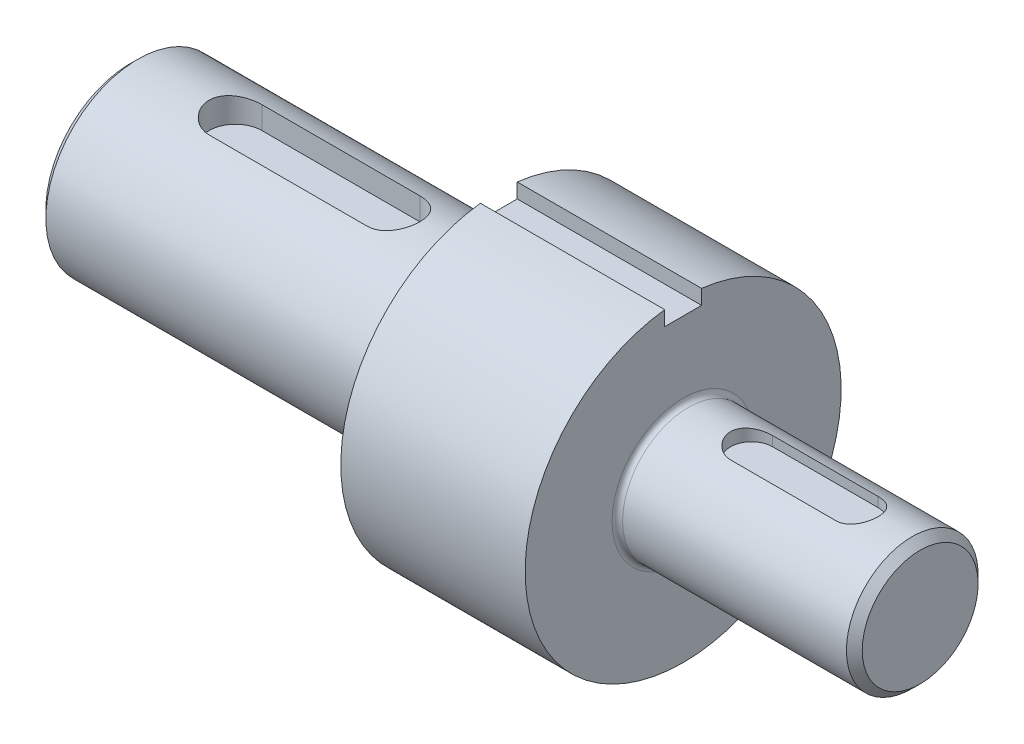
SolidWorks part; units mm, degrees
ref_plane "Ebene vorne" through (0, 0, 0) normal (0, 0, 1) x (1, 0, 0)
ref_plane "Ebene oben" through (0, 0, 0) normal (0, 1, 0) x (1, 0, 0)
ref_plane "Ebene rechts" through (0, 0, 0) normal (1, 0, 0) x (0, 0, -1)
sketch "Skizze1" plane through (0, 0, 0) normal (0, 0, 1) x (1, 0, 0)
  line L0 (0, 0) -> (0, 17.5)
  line L1 (0, 17.5) -> (70, 17.5)
  line L2 (70, 17.5) -> (70, 30)
  line L3 (70, 30) -> (105, 30)
  line L4 (105, 30) -> (105, 12.5)
  line L5 (105, 12.5) -> (150, 12.5)
  line L6 (150, 12.5) -> (150, 0)
  line L7 (150, 0) -> (0, 0)
  line L8 (0, 0) -> (159.1633, 0) construction
  dimension "D1" = 150
  dimension "D2" = 70
  dimension "D3" = 45
  dimension "D4" = 25
  dimension "D5" = 35
  dimension "D6" = 60
revolve "Rotation1" add sketch "Skizze1" angle 360 about L8
sketch "Skizze3" plane through (105, 0, 0) normal (1, 0, 0) x (0, 0, -1)
  line L0 (0, 0) -> (0, 30) construction
  line L2 (-3.5, 33) -> (3.5, 33)
  line L3 (-3.5, 33) -> (-3.5, 27)
  line L4 (-3.5, 27) -> (3.5, 27)
  line L5 (3.5, 33) -> (3.5, 27)
  line L6 (-3.5, 33) -> (3.5, 27) construction
  line L7 (-3.5, 27) -> (3.5, 33) construction
  dimension "D1" = 30
  dimension "D2" = 3
  dimension "D3" = 7
extrude "Schnitt-Linear austragen1" cut sketch "Skizze3" against normal through all
sketch "Skizze4" plane through (0, 0, 0) normal (0, 1, 0) x (1, 0, 0)
  line L0 (118, 0) -> (138, 0) construction
  line L1 (118, 4) -> (138, 4)
  line L2 (118, -4) -> (138, -4)
  line L3 (150, -12.5) -> (150, 12.5) construction
  arc A0 (118, 4) -> (118, -4) centre (118, 0) ccw
  arc A1 (138, -4) -> (138, 4) centre (138, 0) ccw
  point P2 (128, 0)
  dimension "D1" = 8
  dimension "D2" = 20
  dimension "D3" = 12
extrude "Schnitt-Linear austragen2" cut sketch "Skizze4" along normal through all from offset 10
chamfer "Fase1" distance 1.5 angle 45 1 edges at (150, 0, 12.5)
fillet "Verrundung1" radius 1 1 edges at (105, 0, 12.5)
sketch "Skizze5" plane through (0, 0, 0) normal (0, 1, 0) x (1, 0, 0)
  line L0 (20, 0) -> (50, 0) construction
  line L1 (20, 5) -> (50, 5)
  line L2 (20, -5) -> (50, -5)
  line L4 (0, 17.5) -> (0, -17.5) construction
  arc A0 (20, 5) -> (20, -5) centre (20, 0) ccw
  arc A1 (50, -5) -> (50, 5) centre (50, 0) ccw
  point P2 (35, 0)
  dimension "D1" = 10
  dimension "D2" = 30
  dimension "D3" = 20
extrude "Schnitt-Linear austragen3" cut sketch "Skizze5" along normal through all from offset 12.5
chamfer "Fase2" distance 1.5 angle 45 1 edges at (0, 0, 17.5)
fillet "Verrundung2" radius 1 1 edges at (70, 0, 17.5)
